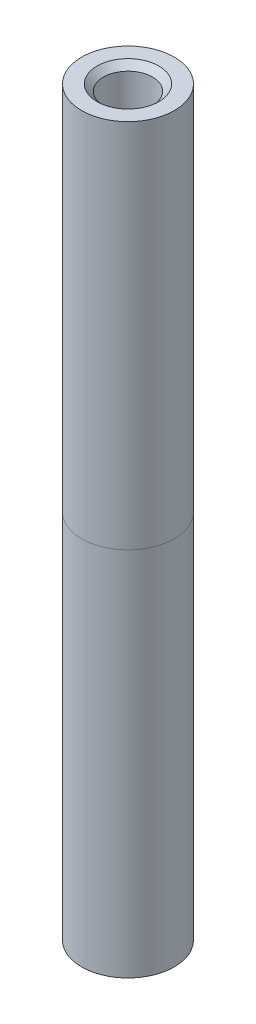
SolidWorks part; units mm, degrees
ref_plane "Plane1" through (0, 0, 0) normal (0, 0, 1) x (1, 0, 0)
ref_plane "Plane2" through (0, 0, 0) normal (0, 1, 0) x (1, 0, 0)
ref_plane "Plane3" through (0, 0, 0) normal (1, 0, 0) x (0, 0, -1)
sketch "Sketch2" plane through (0, 0, 0) normal (0, 0, 1) x (1, 0, 0)
  line L0 (0, 96.266) -> (0, -77.978) construction
  line L1 (69.088, 0) -> (-59.436, 0) construction
  line L2 (4.7625, -53.1787) -> (4.7625, 53.1787)
  line L3 (4.7625, 53.1787) -> (5.0419, 53.34)
  line L4 (5.0419, 53.34) -> (5.0419, 74.8919)
  line L5 (5.0419, 74.8919) -> (6.35, 76.2)
  line L6 (6.35, 76.2) -> (9.525, 76.2)
  line L7 (9.525, 76.2) -> (9.525, -76.2)
  line L8 (6.35, -76.2) -> (9.525, -76.2)
  line L9 (5.0419, -74.8919) -> (6.35, -76.2)
  line L10 (5.0419, -53.34) -> (5.0419, -74.8919)
  line L11 (4.7625, -53.1787) -> (5.0419, -53.34)
  point P13 (9.525, 0)
  point P17 (4.7625, 0)
  dimension "D1" = 9.525
  dimension "D2" = 10.0838
  dimension "D3" = 12.7
  dimension "D4" = 19.05
  dimension "D5" = 45
  dimension "D6" = 60
  dimension "D7" = 22.86
  dimension "D8" = 152.4
revolve "Base-Revolve" add sketch "Sketch2"
sketch "Sketch3" plane through (0, 0, 0) normal (0, 0, 1) x (1, 0, 0)
  line L0 (-27.432, 0) -> (26.67, 0)
